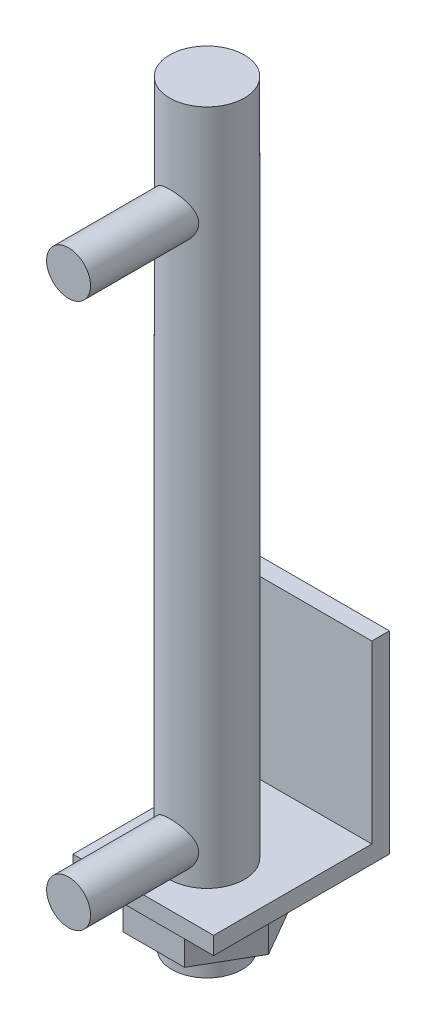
SolidWorks part; units mm, degrees
ref_plane "Ebene vorne" through (0, 0, 0) normal (0, 0, 1) x (1, 0, 0)
ref_plane "Ebene oben" through (0, 0, 0) normal (0, 1, 0) x (1, 0, 0)
ref_plane "Ebene rechts" through (0, 0, 0) normal (1, 0, 0) x (0, 0, -1)
sketch "Skizze1" plane through (0, 0, 0) normal (0, 1, 0) x (1, 0, 0)
  circle A0 centre (0, 0) radius 8.5
extrude "Linear austragen1" add sketch "Skizze1" along normal blind 154
sketch "Skizze3" plane through (0, 0, 0) normal (0, -1, 0) x (1, 0, 0)
  line L1 (-16, 14.5) -> (16, 14.5)
  line L2 (-16, 14.5) -> (-16, -25.5)
  line L3 (-16, -25.5) -> (16, -25.5)
  line L4 (16, 14.5) -> (16, -25.5)
  dimension "D1" = 32
  dimension "D2" = 16
  dimension "D3" = 40
  dimension "D4" = 14.5
extrude "Linear austragen2" add sketch "Skizze3" along normal blind 4
sketch "Skizze4" plane through (0, 0, 0) normal (0, 1, 0) x (1, 0, 0)
  line L0 (16, 25.5) -> (16, -14.5) construction
  line L1 (-16, 25.5) -> (16, 25.5)
  line L2 (-16, 25.5) -> (-16, 21.5)
  line L3 (-16, 21.5) -> (16, 21.5)
  line L4 (16, 25.5) -> (16, 21.5)
  dimension "D1" = 4
extrude "Linear austragen3" add sketch "Skizze4" along normal blind 40
sketch "Skizze5" plane through (0, -4, 0) normal (0, -1, 0) x (1, 0, 0)
  line L1 (14, 0) -> (7, 12.1244)
  line L2 (7, 12.1244) -> (-7, 12.1244)
  line L3 (-7, 12.1244) -> (-14, 0)
  line L4 (-14, 0) -> (-7, -12.1244)
  line L5 (-7, -12.1244) -> (7, -12.1244)
  line L6 (7, -12.1244) -> (14, 0)
  circle A0 centre (0, 0) radius 12.1244 construction
  dimension "D1" = 14
extrude "Linear austragen4" add sketch "Skizze5" along normal blind 8
sketch "Skizze6" plane through (0, -4, 0) normal (0, -1, 0) x (1, 0, 0)
  circle A0 centre (0, 0) radius 8
extrude "Linear austragen5" add sketch "Skizze6" along normal blind 14
ref_point "Punkt1"
ref_plane "Ebene1" through (0, 0, 0) normal (0, 0, 1) x (1, 0, 0)
sketch "Skizze8" plane through (0, 0, 0) normal (0, 0, 1) x (1, 0, 0)
  line L0 (8.5, 0) -> (8.5, 154) construction
  line L1 (16, 0) -> (-16, 0) construction
  circle A0 centre (0, 7) radius 5
  dimension "D1" = 8.5
  dimension "D2" = 7
extrude "Linear austragen6" add sketch "Skizze8" along normal blind 31.5
pattern_linear "Lineares Muster1" count 2 spacing 124 along (0, 1, 0) of "Linear austragen6"
